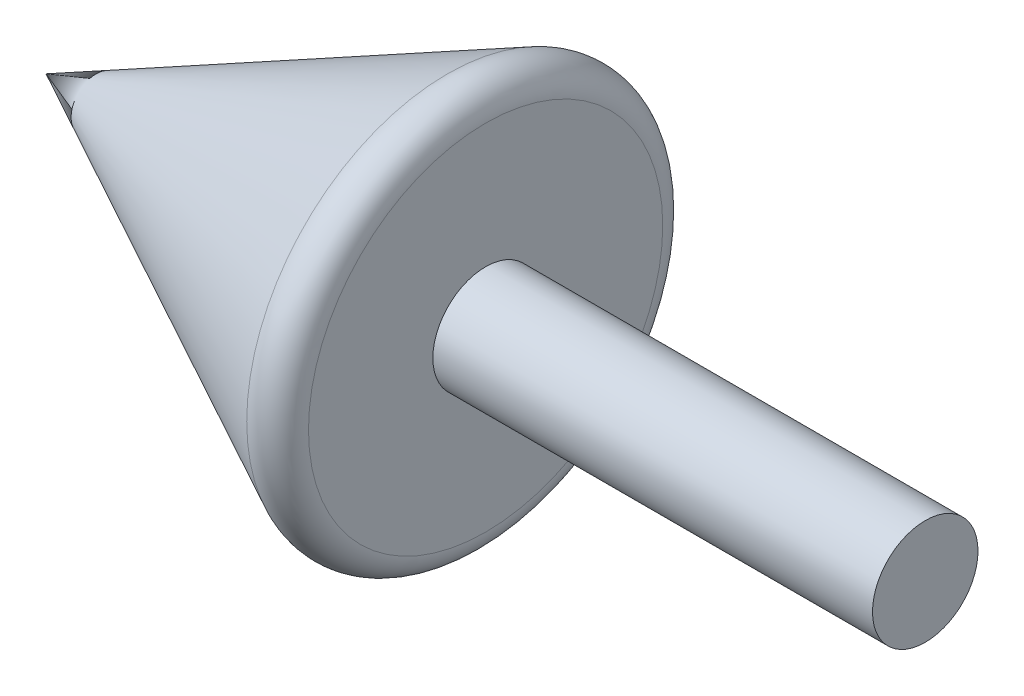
SolidWorks part; units mm, degrees
ref_plane "Front Plane" through (0, 0, 0) normal (0, 0, 1) x (1, 0, 0)
ref_plane "Top Plane" through (0, 0, 0) normal (0, 1, 0) x (1, 0, 0)
ref_plane "Right Plane" through (0, 0, 0) normal (1, 0, 0) x (0, 0, -1)
sketch "Sketch1" plane through (0, 0, 0) normal (0, 0, 1) x (1, 0, 0)
  line L0 (0, 0) -> (50, 25)
  line L1 (0, 0) -> (50, 0)
  line L4 (50, 0) -> (50, 25)
revolve "Revolve1" add sketch "Sketch1" angle 360 about L1
fillet "Fillet1" radius 3 1 edges at (50, 0, 25)
sketch "Sketch3" plane through (50, 0, 0) normal (1, 0, 0) x (0, 0, -1)
  circle A0 centre (0, 0) radius 6
  point P3 (0, 0)
extrude "Boss-Extrude1" add sketch "Sketch3" along normal blind 50
